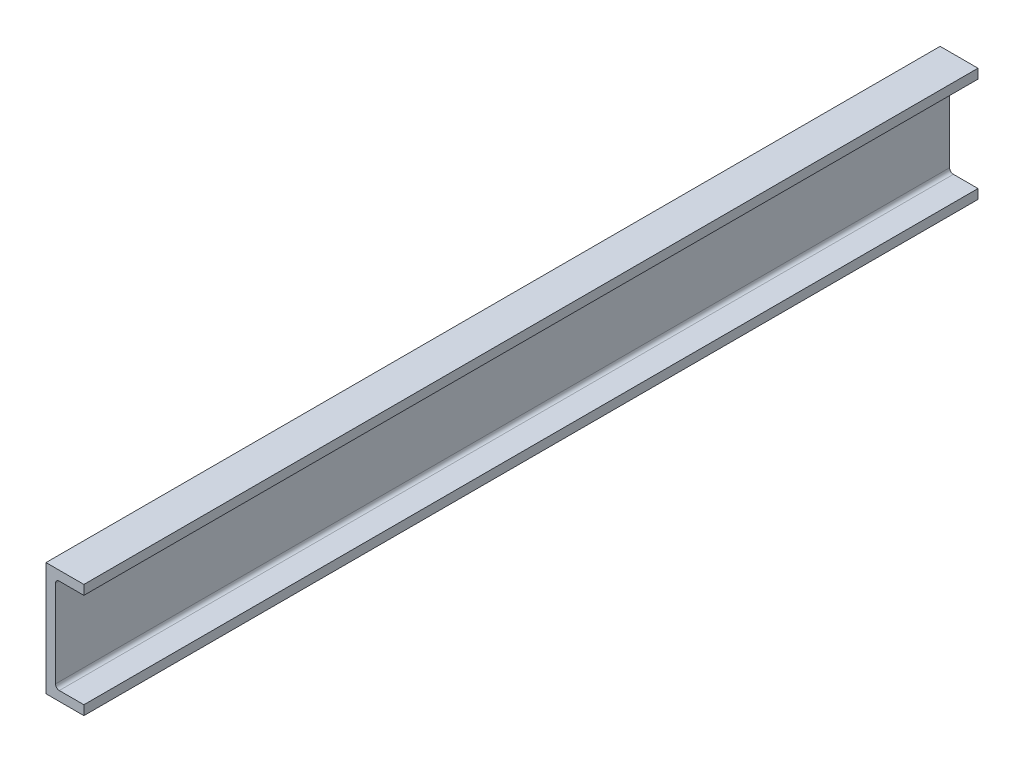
SolidWorks part; units mm, degrees
ref_plane "Front Plane" through (0, 0, 0) normal (0, 0, 1) x (1, 0, 0)
ref_plane "Top Plane" through (0, 0, 0) normal (0, 1, 0) x (1, 0, 0)
ref_plane "Right Plane" through (0, 0, 0) normal (1, 0, 0) x (0, 0, -1)
sketch "Sketch1" plane through (0, 0, 0) normal (0, 0, 1) x (1, 0, 0)
  line L0 (0, 0) -> (0, 76.2)
  line L1 (0, 76.2) -> (25.4, 76.2)
  line L2 (25.4, 76.2) -> (25.4, 69.85)
  line L3 (25.4, 69.85) -> (6.35, 69.85)
  line L4 (6.35, 69.85) -> (6.35, 6.35)
  line L5 (6.35, 6.35) -> (25.4, 6.35)
  line L6 (25.4, 6.35) -> (25.4, 0)
  line L7 (25.4, 0) -> (0, 0)
  dimension "D1" = 76.2
  dimension "D2" = 25.4
  dimension "D3" = 6.35
  dimension "D4" = 19.05
  dimension "D5" = 6.35
extrude "Boss-Extrude1" add sketch "Sketch1" against normal blind 599.44
fillet "Fillet1" radius 2.54 2 edges at (6.35, 6.35, -299.72) (6.35, 69.85, -299.72)
